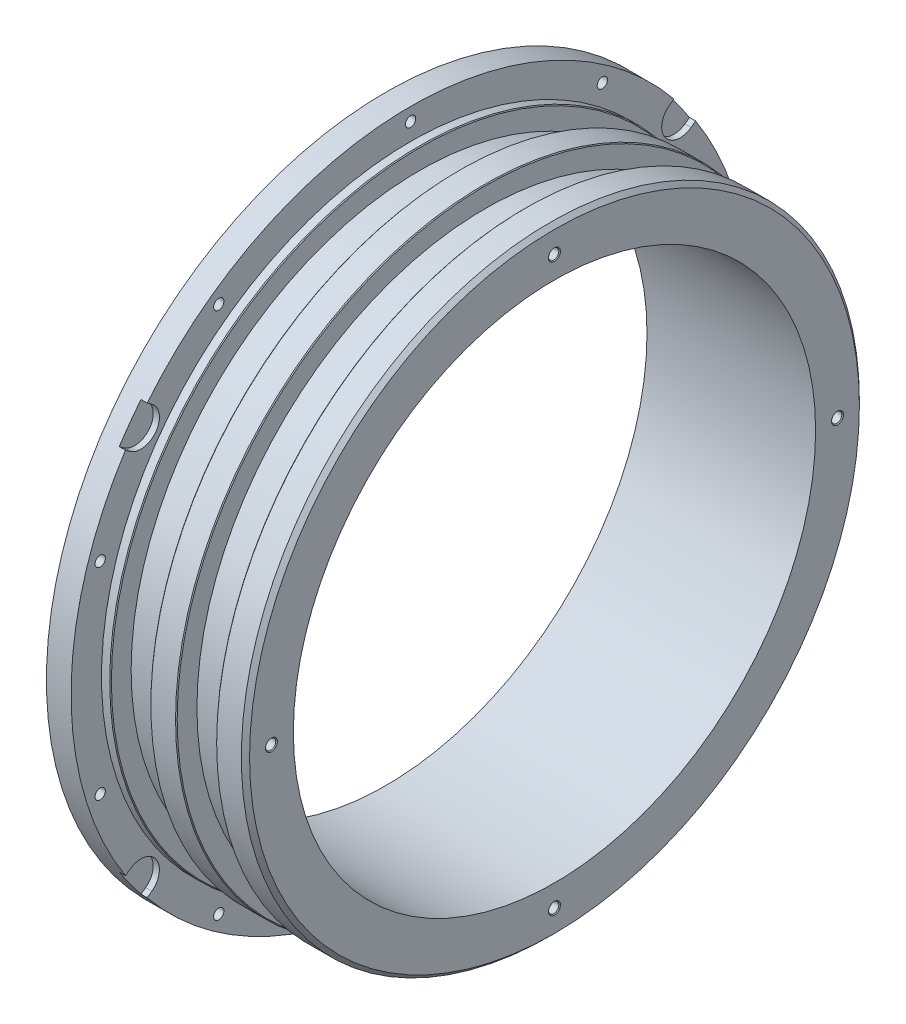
SolidWorks part; units mm, degrees
other "<WTE6-M-FLANGE-SEAL-R1>-<Cut-Extrude1>"
ref_plane "Front Plane" through (0, 0, 0) normal (0, 0, 1) x (1, 0, 0)
ref_plane "Top Plane" through (0, 0, 0) normal (0, 1, 0) x (1, 0, 0)
ref_plane "Right Plane" through (0, 0, 0) normal (1, 0, 0) x (0, 0, -1)
inserted part "WTE6-M-FLANGE-SEAL-R1"
